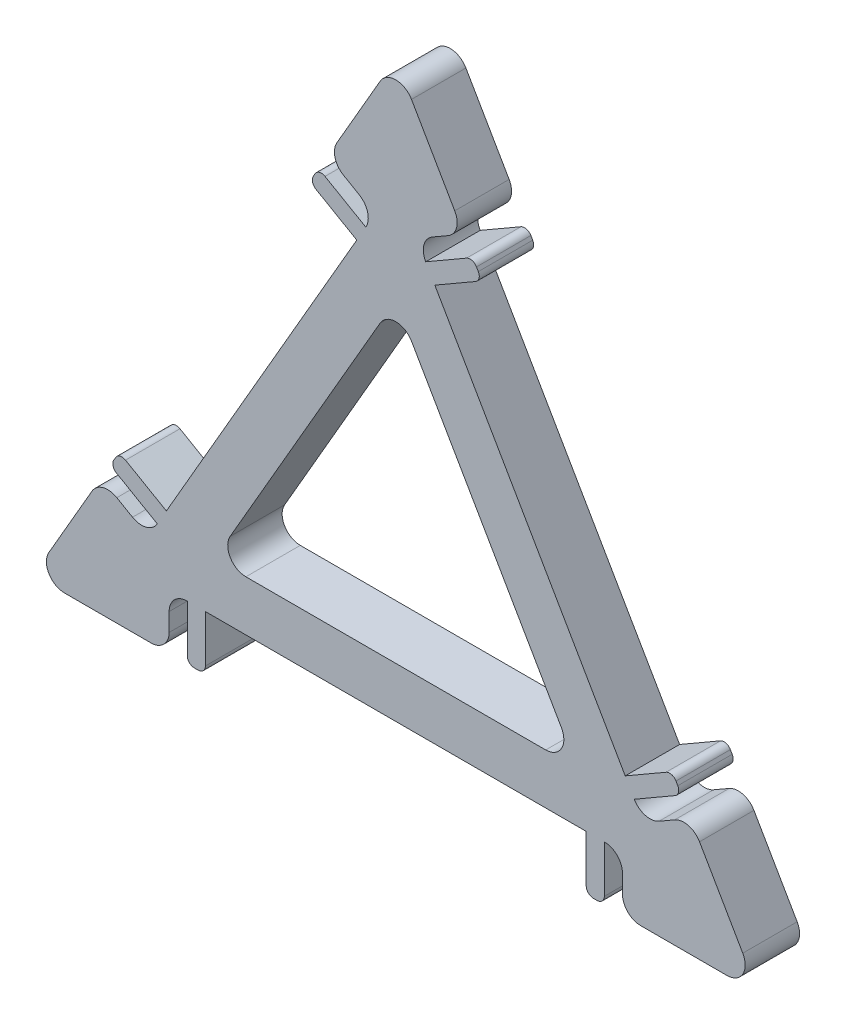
SolidWorks part; units mm, degrees
ref_plane "Front Plane" through (0, 0, 0) normal (0, 0, 1) x (1, 0, 0)
ref_plane "Top Plane" through (0, 0, 0) normal (0, 1, 0) x (1, 0, 0)
ref_plane "Right Plane" through (0, 0, 0) normal (1, 0, 0) x (0, 0, -1)
sketch "Sketch1" plane through (0, 0, 0) normal (0, 0, 1) x (1, 0, 0)
  line L0 (3.25, 17.4648) -> (0.866, 21.594)
  line L1 (-18.2679, -11.547) -> (-13.5, -11.547)
  line L2 (19.134, -10.047) -> (16.75, -5.9178)
  line L3 (-0.866, 21.594) -> (-3.25, 17.4648)
  line L4 (-8.2679, -5.7715) -> (8.266, -5.7744)
  line L5 (9.1322, -4.2745) -> (0.8678, 10.0457)
  line L6 (-0.8643, 10.046) -> (-9.1337, -4.2713)
  line L7 (-2.884, 16.0988) -> (-2.0179, 15.5988)
  line L8 (-15.384, -5.5518) -> (-14.5179, -6.0518)
  line L9 (-1.6519, 14.2328) -> (-13.1519, -5.6858)
  line L10 (0, 21.094) -> (0, -16.8194) construction
  line L11 (15.384, -5.5518) -> (14.5179, -6.0518)
  line L12 (1.6519, 14.2328) -> (13.1519, -5.6858)
  line L13 (2.884, 16.0988) -> (2.0179, 15.5988)
  line L14 (-16.75, -5.9178) -> (-19.134, -10.047)
  line L15 (-20, -11.547) -> (0, 0) construction
  line L16 (12.5, -10.547) -> (12.5, -9.547)
  line L17 (11.5, -8.547) -> (-11.5, -8.547)
  line L18 (-12.5, -10.547) -> (-12.5, -9.547)
  line L19 (13.5, -11.547) -> (18.2679, -11.547)
  circle A0 centre (0, 0) radius 11.547 construction
  circle A1 centre (0, 0) radius 5.7729 construction
  arc A2 (0.866, 21.594) -> (-0.866, 21.594) centre (0, 21.094) ccw
  arc A3 (19.134, -10.047) -> (18.2679, -11.547) centre (18.2679, -10.547) cw
  arc A4 (-18.2679, -11.547) -> (-19.134, -10.047) centre (-18.2679, -10.547) cw
  arc A5 (8.266, -5.7744) -> (9.1322, -4.2745) centre (8.2661, -4.7744) ccw
  arc A6 (-8.2679, -5.7715) -> (-9.1337, -4.2713) centre (-8.2678, -4.7715) cw
  arc A7 (-0.8643, 10.046) -> (0.8678, 10.0457) centre (0.0016, 9.5459) cw
  arc A8 (15.384, -5.5518) -> (16.75, -5.9178) centre (15.884, -6.4178) cw
  arc A9 (13.1519, -5.6858) -> (14.5179, -6.0518) centre (14.0179, -5.1858) ccw
  arc A10 (13.5, -11.547) -> (12.5, -10.547) centre (13.5, -10.547) cw
  arc A11 (12.5, -9.547) -> (11.5, -8.547) centre (11.5, -9.547) ccw
  arc A12 (-12.5, -9.547) -> (-11.5, -8.547) centre (-11.5, -9.547) cw
  arc A13 (-13.5, -11.547) -> (-12.5, -10.547) centre (-13.5, -10.547) ccw
  arc A14 (-14.5179, -6.0518) -> (-13.1519, -5.6858) centre (-14.0179, -5.1858) ccw
  arc A15 (-16.75, -5.9178) -> (-15.384, -5.5518) centre (-15.884, -6.4178) cw
  arc A16 (3.25, 17.4648) -> (2.884, 16.0988) centre (2.384, 16.9648) cw
  arc A17 (1.6519, 14.2328) -> (2.0179, 15.5988) centre (2.5179, 14.7328) cw
  arc A18 (-1.6519, 14.2328) -> (-2.0179, 15.5988) centre (-2.5179, 14.7328) ccw
  arc A19 (-2.884, 16.0988) -> (-3.25, 17.4648) centre (-2.384, 16.9648) cw
  point P12 (0, 23.094)
  point P17 (-20, -11.547)
  point P25 (9.998, -5.7747)
  point P28 (-10, -5.7712)
  point P42 (16.25, -5.0518)
  point P45 (13.6519, -6.5518)
  point P48 (12.5, -11.547)
  point P51 (12.5, -8.547)
  point P54 (-12.5, -8.547)
  point P57 (-12.5, -11.547)
  point P60 (-13.6519, -6.5518)
  point P63 (-16.25, -5.0518)
  point P66 (3.75, 16.5988)
  point P69 (1.1519, 15.0988)
  point P72 (-1.1519, 15.0988)
  point P75 (-3.75, 16.5988)
  dimension "D1" = 1
  dimension "D4" = 1
  dimension "D10" = 1
  dimension "D13" = 1
  dimension "D2" = 20
  dimension "D3" = 40
  dimension "D5" = 3
  dimension "D6" = 25
  dimension "D7" = 7.5
  dimension "D8" = 19.998
  dimension "D9" = 10
  dimension "D11" = 4.616
  dimension "D12" = 1.1519
extrude "Boss-Extrude1" add sketch "Sketch1" along normal blind 3
sketch "Sketch2" plane through (0, 0, 3) normal (0, 0, 1) x (1, 0, 0)
  line L0 (-1.6519, 14.2328) -> (-2.1519, 13.3668)
  line L1 (-1.6519, 14.2328) -> (-3.9036, 15.5328)
  line L2 (-2.1519, 13.3668) -> (-4.4036, 14.6668)
  line L3 (-4.45, 15.3864) -> (-4.55, 15.2132)
  line L4 (-1.6519, 14.2328) -> (-13.1519, -5.6858) construction
  line L5 (-2.884, 16.0988) -> (-2.0179, 15.5988) construction
  line L6 (19.134, -11.047) -> (-13.3233, 7.6922) construction
  line L7 (-19.134, -11.047) -> (0, 0) construction
  line L8 (0, 0) -> (0, 26.777) construction
  line L9 (-15.55, -3.8394) -> (-15.45, -3.6662)
  line L10 (-13.1519, -5.6858) -> (-15.4036, -4.3858)
  line L11 (-12.6519, -4.8198) -> (-14.9036, -3.5198)
  line L13 (12.6519, -4.8198) -> (14.9036, -3.5198)
  line L14 (13.1519, -5.6858) -> (15.4036, -4.3858)
  line L15 (15.55, -3.8394) -> (15.45, -3.6662)
  line L16 (4.45, 15.3864) -> (4.55, 15.2132)
  line L17 (2.1519, 13.3668) -> (4.4036, 14.6668)
  line L18 (1.6519, 14.2328) -> (3.9036, 15.5328)
  line L19 (1.6519, 14.2328) -> (2.1519, 13.3668)
  line L20 (-10.5, -8.547) -> (-10.5, -11.147)
  line L21 (-11.5, -8.547) -> (-11.5, -11.147)
  line L22 (-11.1, -11.547) -> (-10.9, -11.547)
  line L23 (11.1, -11.547) -> (10.9, -11.547)
  line L24 (10.5, -8.547) -> (10.5, -11.147)
  line L25 (11.5, -8.547) -> (11.5, -11.147)
  line L26 (11.5, -8.547) -> (10.5, -8.547)
  arc A0 (-4.4036, 14.6668) -> (-4.55, 15.2132) centre (-4.2036, 15.0132) cw
  arc A1 (-4.45, 15.3864) -> (-3.9036, 15.5328) centre (-4.1036, 15.1864) cw
  arc A2 (18.2679, -11.547) -> (19.134, -10.047) centre (18.2679, -10.547) ccw construction
  arc A3 (-19.134, -10.047) -> (-18.2679, -11.547) centre (-18.2679, -10.547) ccw construction
  arc A4 (-14.9036, -3.5198) -> (-15.45, -3.6662) centre (-15.1036, -3.8662) ccw
  arc A5 (-15.55, -3.8394) -> (-15.4036, -4.3858) centre (-15.2036, -4.0394) ccw
  arc A6 (15.55, -3.8394) -> (15.4036, -4.3858) centre (15.2036, -4.0394) cw
  arc A7 (14.9036, -3.5198) -> (15.45, -3.6662) centre (15.1036, -3.8662) cw
  arc A8 (4.45, 15.3864) -> (3.9036, 15.5328) centre (4.1036, 15.1864) ccw
  arc A9 (4.4036, 14.6668) -> (4.55, 15.2132) centre (4.2036, 15.0132) ccw
  arc A10 (-11.1, -11.547) -> (-11.5, -11.147) centre (-11.1, -11.147) cw
  arc A11 (-10.5, -11.147) -> (-10.9, -11.547) centre (-10.9, -11.147) cw
  arc A12 (11.1, -11.547) -> (11.5, -11.147) centre (11.1, -11.147) ccw
  arc A13 (10.5, -11.147) -> (10.9, -11.547) centre (10.9, -11.147) ccw
  point P11 (-4.75, 14.8668)
  point P14 (-4.25, 15.7328)
  point P51 (4.25, 15.7328)
  point P52 (4.75, 14.8668)
  point P69 (11.5, -11.547)
  point P70 (10.5, -11.547)
  dimension "D4" = 0.4
  dimension "D1" = 3
  dimension "D2" = 1
  dimension "D3" = 1
extrude "Boss-Extrude2" add sketch "Sketch2" against normal blind 3 contours A11 L20 L21 A10 L22 M25 | L9 A5 L10 L11 A4 M15 | L17 A9 L16 A8 L18 M35 | A1 L3 A0 L2 L1 M15 | A7 L13 L14 A6 L15 M35 | L24 A13 L23 A12 L25 M25
